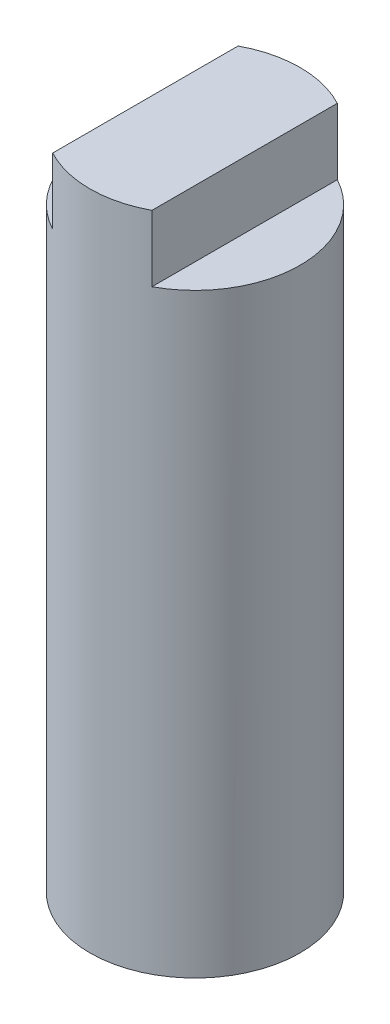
SolidWorks part; units mm, degrees
ref_plane "Front Plane" through (0, 0, 0) normal (0, 0, 1) x (1, 0, 0)
ref_plane "Top Plane" through (0, 0, 0) normal (0, 1, 0) x (1, 0, 0)
ref_plane "Right Plane" through (0, 0, 0) normal (1, 0, 0) x (0, 0, -1)
sketch "Sketch1" plane through (0, 0, 0) normal (0, 1, 0) x (1, 0, 0)
  circle A0 centre (0, 0) radius 3.1775
  dimension "D1" = 6.355
extrude "Boss-Extrude1" add sketch "Sketch1" along normal mid plane 20
sketch "Sketch2" plane through (0, 10, 0) normal (0, 1, 0) x (1, 0, 0)
  line L1 (1.5, -3.4425) -> (-1.5, -3.4425)
  line L2 (1.5, -3.4425) -> (1.5, 3.4425)
  line L3 (1.5, 3.4425) -> (-1.5, 3.4425)
  line L4 (-1.5, -3.4425) -> (-1.5, 3.4425)
  line L5 (1.5, -3.4425) -> (-1.5, 3.4425) construction
  line L6 (1.5, 3.4425) -> (-1.5, -3.4425) construction
  point P0 (0, 0)
  dimension "D1" = 3
extrude "Cut-Extrude1" cut sketch "Sketch2" against normal blind 2 flip side to cut
